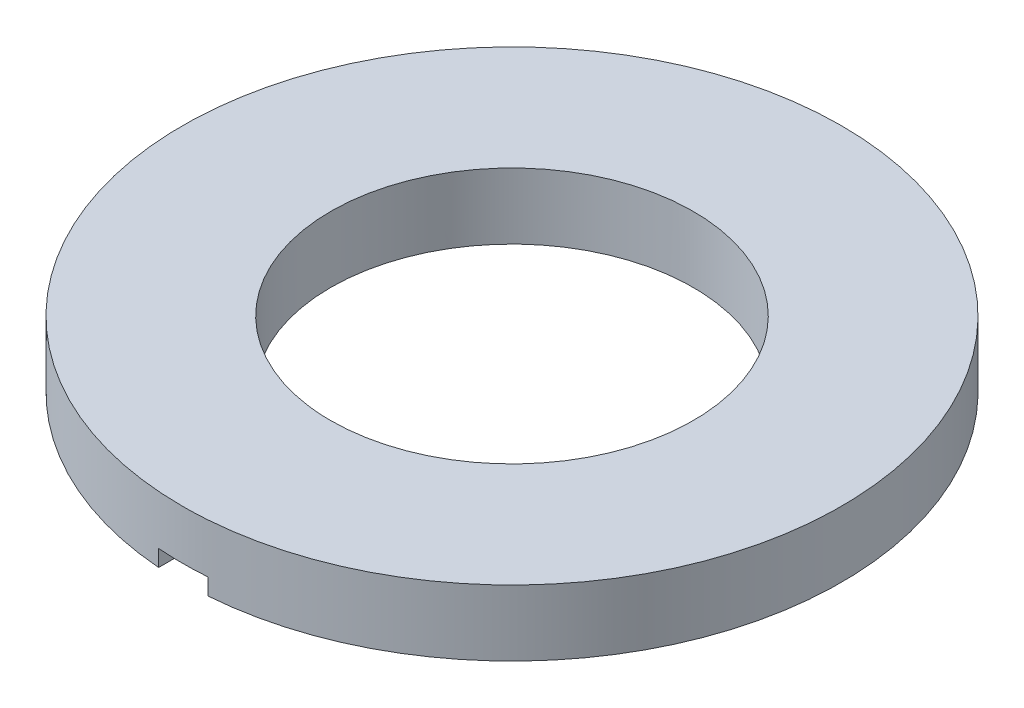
SolidWorks part; units mm, degrees
ref_plane "Front Plane" through (0, 0, 0) normal (0, 0, 1) x (1, 0, 0)
ref_plane "Top Plane" through (0, 0, 0) normal (0, 1, 0) x (1, 0, 0)
ref_plane "Right Plane" through (0, 0, 0) normal (1, 0, 0) x (0, 0, -1)
sketch "Sketch1" plane through (0, 0, 0) normal (0, 1, 0) x (1, 0, 0)
  circle A0 centre (0, 0) radius 5.5
  circle A1 centre (0, 0) radius 10
  dimension "D1" = 11
  dimension "D2" = 20
extrude "Extrude1" add sketch "Sketch1" along normal blind 2
sketch "Sketch2" plane through (0, 0, 0) normal (0, -1, 0) x (1, 0, 0)
  line L1 (-0.75, 1) -> (0.75, 1)
  line L2 (-0.75, 1) -> (-0.75, 10)
  line L3 (-0.75, 10) -> (0.75, 10)
  line L4 (0.75, 1) -> (0.75, 10)
  line L5 (-0.75, 1) -> (0.75, 10) construction
  line L6 (-0.75, 10) -> (0.75, 1) construction
  circle A0 centre (0, 0) radius 5.5 construction
  circle A1 centre (0, 0) radius 10 construction
  point P0 (0, 5.5)
  dimension "D1" = 1.5
extrude "Cut-Extrude1" cut sketch "Sketch2" against normal blind 0.5
